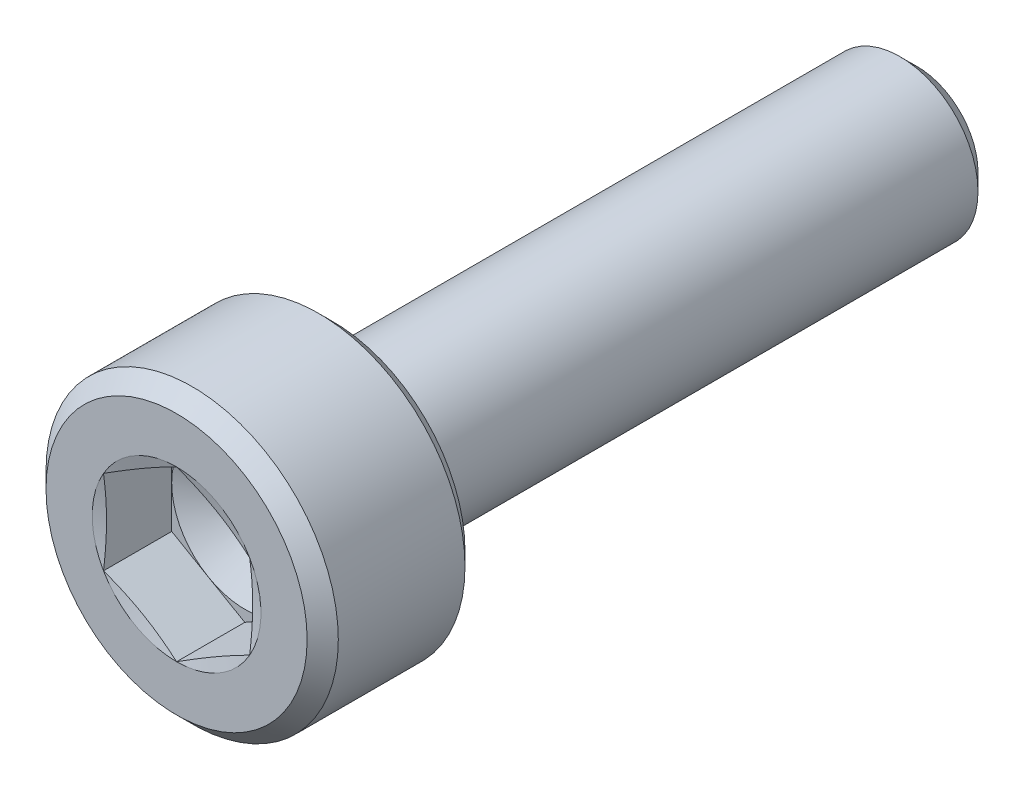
SolidWorks part; units mm, degrees
ref_plane "Front Plane" through (0, 0, 0) normal (0, 0, 1) x (1, 0, 0)
ref_plane "Top Plane" through (0, 0, 0) normal (0, 1, 0) x (1, 0, 0)
ref_plane "Right Plane" through (0, 0, 0) normal (1, 0, 0) x (0, 0, -1)
sketch "Sketch1" plane through (0, 0, 0) normal (1, 0, 0) x (0, 0, -1)
  line L0 (0, 0) -> (12.9407, 0) construction
  line L1 (0, 0) -> (0, 1.34)
  line L2 (0, 1.34) -> (0.16, 1.5)
  line L3 (0.16, 1.5) -> (1.46, 1.5)
  line L4 (1.6, 1.36) -> (1.6, 1)
  line L5 (1.94, 0.8) -> (7.425, 0.8)
  line L6 (7.425, 0.8) -> (7.6, 0.625)
  line L7 (7.6, 0.625) -> (7.6, 0)
  line L8 (7.6, 0) -> (0, 0)
  line L9 (1.46, 1.5) -> (1.6, 1.36)
  line L10 (1.9015, 0.8077) -> (1.6615, 0.9077)
  arc A2 (1.94, 0.8) -> (1.9015, 0.8077) centre (1.94, 0.9) cw
  arc A3 (1.6615, 0.9077) -> (1.6, 1) centre (1.7, 1) cw
  point P6 (1.6, 1.5)
  dimension "R2" = 0.1
  dimension "R1" = 0.1
  dimension "D1" = 45
  dimension "DK" = 3
  dimension "D3" = 45
  dimension "length" = 6
  dimension "K" = 1.6
  dimension "V" = 0.16
  dimension "HOLESIZE" = 1.6
  dimension "D4" = 1.25
  dimension "D5" = 45
  dimension "DW" = 2.72
  dimension "F" = 0.34
  dimension "DA" = 2
revolve "Revolve1" add sketch "Sketch1" angle 360 about L0
sketch "Sketch2" plane through (0, 0, 0) normal (0, 0, 1) x (1, 0, 0)
  line L0 (0, 0) -> (0, 0.866) construction
  line L2 (0, 0.866) -> (-0.75, 0.433)
  line L3 (-0.75, 0.433) -> (-0.75, -0.433)
  line L4 (-0.75, -0.433) -> (0, -0.866)
  line L5 (0, -0.866) -> (0.75, -0.433)
  line L6 (0.75, -0.433) -> (0.75, 0.433)
  line L7 (0.75, 0.433) -> (0, 0.866)
  circle A0 centre (0, 0) radius 0.75 construction
  dimension "S" = 1.5
extrude "Cut-Extrude1" cut sketch "Sketch2" against normal blind 0.7
sketch "Sketch3" plane through (0, 0, 0) normal (1, 0, 0) x (0, 0, -1)
  line L0 (0.7, 0) -> (7.6, 0) construction
  line L1 (7.6, -0.625) -> (7.6, 0.625) construction
  line L2 (0.7, 0) -> (0.7, 0.75)
  line L4 (0.7, 0.75) -> (1.133, 0)
  line L5 (1.133, 0) -> (0.7, 0)
  line L6 (0, 1.34) -> (0, -1.34) construction
  dimension "DRILLANG" = 60
  dimension "DRILL DEPTH" = 0.7
  dimension "S2" = 1.5
revolve "Cut-Revolve2" cut sketch "Sketch3" angle 360 about L0
sketch "Sketch4" plane through (0, 0, 0) normal (1, 0, 0) x (0, 0, -1)
  line L0 (0, 0) -> (4.6121, 0) construction
  line L1 (0, 0.866) -> (0, 0.75)
  line L2 (0, 1.34) -> (0, -1.34) construction
  line L3 (0, 0.75) -> (0.0311, 0.75)
  line L4 (0.0311, 0.75) -> (0, 0.866)
  point P12 (0.0155, 0.75)
  dimension "D1" = 1.5
  dimension "D2" = 15
revolve "Cut-Revolve3" cut sketch "Sketch4" angle 360 about L0
